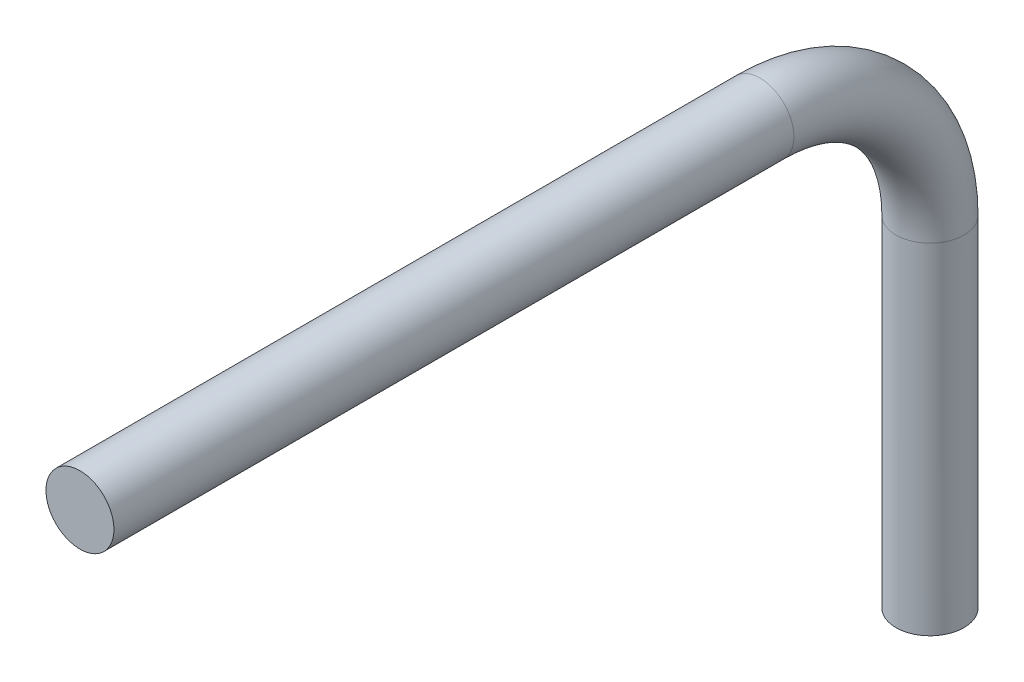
SolidWorks part; units mm, degrees
ref_plane "Front Plane" through (0, 0, 0) normal (0, 0, 1) x (1, 0, 0)
ref_plane "Top Plane" through (0, 0, 0) normal (0, 1, 0) x (1, 0, 0)
ref_plane "Right Plane" through (0, 0, 0) normal (1, 0, 0) x (0, 0, -1)
sketch "Sketch1" plane through (0, 0, 0) normal (1, 0, 0) x (0, 0, -1)
  line L0 (0, 0) -> (100, 0)
  line L1 (125, -25) -> (125, -75)
  arc A0 (100, 0) -> (125, -25) centre (100, -25) cw
  dimension "D1" = 25
  dimension "D2" = 125
  dimension "D3" = 75
sketch "Sketch2" plane through (0, 0, 0) normal (0, 0, 1) x (1, 0, 0)
  circle A0 centre (0, 0) radius 5
  dimension "D1" = 10
sweep "Sweep1" add profiles "Sketch2" path "Sketch1"
